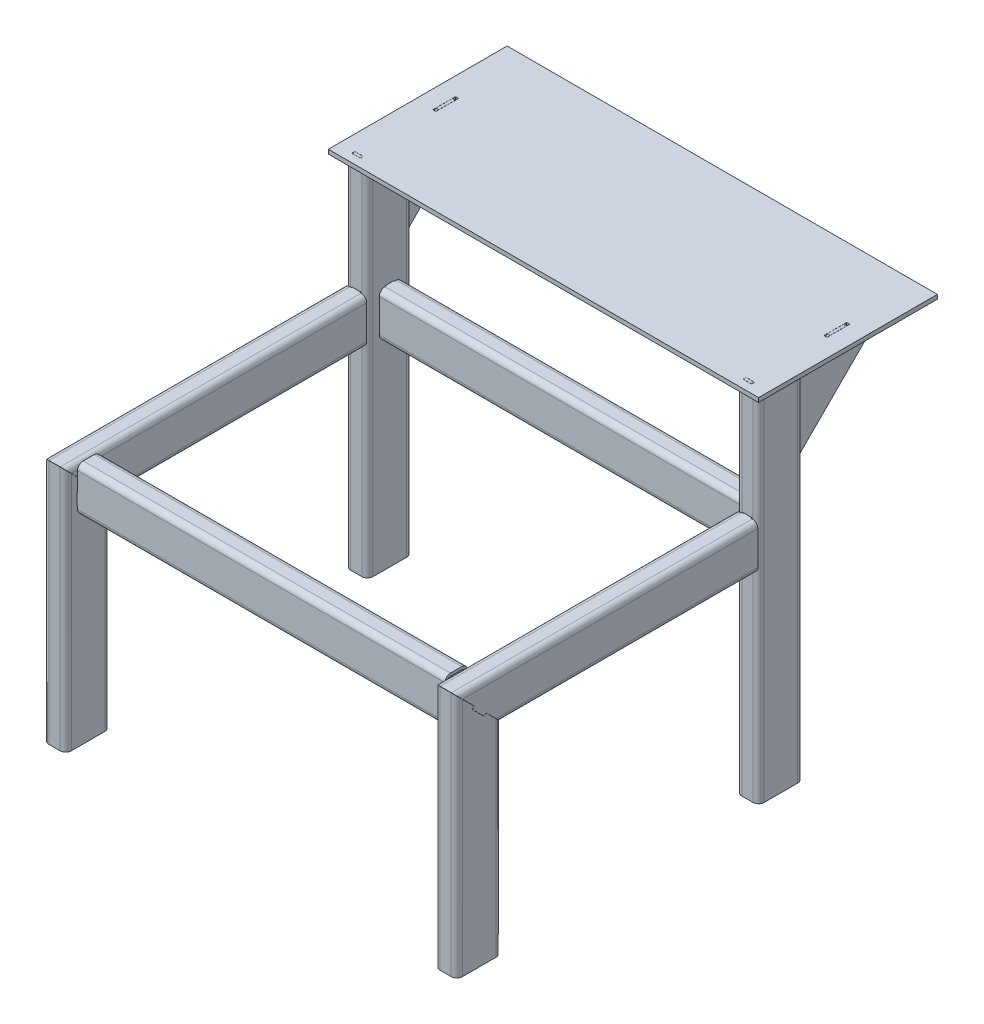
SolidWorks part; units mm, degrees
other "ExplView1" [suppressed]
other "Explode Step1" [suppressed]
other "Explode Line1"
other "Explode Line2"
other "Explode Line3"
other "Explode Line4"
other "Explode Line5"
other "Explode Line6"
other "Explode Step2" [suppressed]
other "Explode Line1"
other "Explode Line2"
other "Explode Line3"
other "Explode Line4"
other "Explode Line5"
other "Explode Line6"
other "Explode Line7"
other "Explode Line8"
other "Explode Step3" [suppressed]
other "Explode Line1"
other "Explode Line2"
other "Explode Line3"
other "Explode Line4"
other "Explode Line5"
other "Explode Line6"
other "Explode Step4" [suppressed]
other "Explode Line1"
other "Explode Line2"
other "Explode Line3"
other "Explode Line4"
other "Explode Step5" [suppressed]
other "Explode Line1"
other "Explode Step6" [suppressed]
other "Explode Line1"
other "Explode Line2"
ref_plane "Front Plane" through (0, 0, 0) normal (0, 0, 1) x (1, 0, 0)
ref_plane "Top Plane" through (0, 0, 0) normal (0, 1, 0) x (1, 0, 0)
ref_plane "Right Plane" through (0, 0, 0) normal (1, 0, 0) x (0, 0, -1)
sketch3d "3DSketch1"
  line L0 (0, 0, 0) -> (0, 558.8, 0)
  line L1 (0, 558.8, 0) -> (889, 558.8, 0)
  line L2 (889, 558.8, 0) -> (889, 0, 0)
  line L3 (889, 0, 0) -> (0, 0, 0) construction
  line L4 (0, 0, 0) -> (0, 0, -685.8) construction
  line L5 (0, 0, -685.8) -> (889, 0, -685.8) construction
  line L6 (889, 0, -685.8) -> (889, 0, 0) construction
  line L7 (0, 0, -685.8) -> (0, 812.8, -685.8)
  line L8 (889, 0, -685.8) -> (889, 812.8, -685.8)
  line L9 (889, 812.8, -685.8) -> (0, 812.8, -685.8) construction
  line L10 (0, 558.8, 0) -> (0, 558.8, -685.8)
  line L11 (0, 558.8, -685.8) -> (889, 558.8, -685.8)
  line L12 (889, 558.8, -685.8) -> (889, 558.8, 0)
  dimension "D2" = 685.8
  dimension "D1" = 558.8
  dimension "D3" = 889
  dimension "D4" = 812.8
other "Rectangular tube 4 X 2 X 0.25(2)"
ref_plane "Plane1" through (0, 0, 0) normal (0, 1, 0) x (1, 0, 0)
sketch "Sketch1" plane through (0, 0, 0) normal (0, 1, 0) x (1, 0, 0)
  line L0 (-12.7, -44.45) -> (12.7, -44.45)
  line L1 (-19.05, -38.1) -> (-19.05, 38.1)
  line L2 (12.7, 44.45) -> (-12.7, 44.45)
  line L3 (19.05, 38.1) -> (19.05, -38.1)
  line L4 (-12.7, -50.8) -> (12.7, -50.8)
  line L5 (-25.4, -38.1) -> (-25.4, 38.1)
  line L6 (12.7, 50.8) -> (-12.7, 50.8)
  line L7 (25.4, 38.1) -> (25.4, -38.1)
  line L8 (0, 0) -> (25.4, 0) construction
  line L9 (0, 0) -> (0, 50.8) construction
  arc A0 (25.4, 38.1) -> (12.7, 50.8) centre (12.7, 38.1) ccw
  arc A1 (12.7, -50.8) -> (25.4, -38.1) centre (12.7, -38.1) ccw
  arc A2 (-25.4, -38.1) -> (-12.7, -50.8) centre (-12.7, -38.1) ccw
  arc A3 (-12.7, 50.8) -> (-25.4, 38.1) centre (-12.7, 38.1) ccw
  arc A4 (-12.7, 44.45) -> (-19.05, 38.1) centre (-12.7, 38.1) ccw
  arc A5 (19.05, 38.1) -> (12.7, 44.45) centre (12.7, 38.1) ccw
  arc A6 (12.7, -44.45) -> (19.05, -38.1) centre (12.7, -38.1) ccw
  arc A7 (-19.05, -38.1) -> (-12.7, -44.45) centre (-12.7, -38.1) ccw
  point P3 (0, -50.8)
  point P4 (-25.4, 0)
  point P5 (0, 0)
  point P6 (25.4, -50.8)
  point P7 (-25.4, -50.8)
  point P8 (-25.4, 50.8)
  point P33 (0, 0)
  point P35 (25.4, 50.8)
  point P36 (25.4, 0)
  point P37 (0, 50.8)
  dimension "D1" = 12.7
  dimension "Thickness" = 6.35
  dimension "V_leg" = 101.6
  dimension "H_leg" = 50.8
sketch "Sketch2" plane through (0, 812.8, 0) normal (0, 1, 0) x (1, 0, 0)
  line L0 (-12.7, 635) -> (12.7, 635) construction
  line L1 (-44.45, 615.95) -> (933.45, 615.95)
  line L2 (-44.45, 615.95) -> (-44.45, 1022.35)
  line L3 (-44.45, 1022.35) -> (933.45, 1022.35)
  line L4 (933.45, 615.95) -> (933.45, 1022.35)
  line L5 (-25.4, 723.9) -> (-25.4, 647.7) construction
  line L6 (914.4, 647.7) -> (914.4, 723.9) construction
  dimension "D1" = 19.05
  dimension "D2" = 19.05
  dimension "D3" = 19.05
  dimension "D4" = 406.4
extrude "Boss-Extrude1" add sketch "Sketch2" along normal blind 9.525 separate body
other "Trim/Extend1"
other "Trim/Extend2"
other "Gusset1" parameters "D1"=6.35, "D2"=6.35, "D3"=0, "D4"=0, "D10"=6.35, "D11"=203.2, "D12"=203.2, "D13"=12.7, "D14"=45, "D15"=12.7
sketch "Sketch14" plane through (0, 812.8, -736.6) normal (1, 0, 0) x (0, 0, -1)
  line L0 (0, 0) -> (203.2, 0)
  line L1 (0, 0) -> (0, -203.2)
  line L2 (203.2, 0) -> (0, -203.2)
other "Gusset2" parameters "D1"=6.35, "D2"=6.35, "D3"=0, "D4"=0, "D10"=6.35, "D11"=203.2, "D12"=203.2, "D13"=12.7, "D14"=45, "D15"=12.7
sketch "Sketch15" plane through (889, 812.8, -736.6) normal (1, 0, 0) x (0, 0, -1)
  line L0 (0, 0) -> (203.2, 0)
  line L1 (0, 0) -> (0, -203.2)
  line L2 (203.2, 0) -> (0, -203.2)
tab and slot "Tab and Slot-Tab1" parameters "D110"=6.35, "D18"=44.45, "D19"=0, "D10"=25.4, "D11"=1, "D17"=0.254
tab and slot "Tab and Slot-Slot1"
tab and slot "Tab and Slot-Tab2" parameters "D410"=6.35, "D48"=38.1, "D49"=0, "D40"=38.1, "D41"=1, "D43"=3.81, "D47"=0.254, "D510"=6.35, "D58"=38.1, "D59"=0, "D50"=38.1, "D51"=1, "D53"=6.35, "D57"=0.254
tab and slot "Tab and Slot-Slot2"
tab and slot "Tab and Slot-Tab3" parameters "D110"=6.35, "D18"=3.175, "D19"=0, "D10"=19.05, "D11"=1, "D17"=0.254, "D210"=6.35, "D28"=3.175, "D29"=0, "D20"=19.05, "D21"=1, "D27"=0.254
tab and slot "Tab and Slot-Slot3"
tab and slot "Tab and Slot-Tab4" parameters "D110"=6.35, "D18"=3.175, "D19"=0, "D10"=19.05, "D11"=1, "D13"=0, "D17"=0.254, "D210"=6.35, "D28"=3.175, "D29"=0, "D20"=19.05, "D21"=1, "D27"=0.254
tab and slot "Tab and Slot-Slot4"
tab and slot "Tab and Slot-Tab5" parameters "D110"=6.35, "D18"=3.175, "D19"=0, "D10"=11.43, "D11"=1, "D17"=0.254, "D210"=6.35, "D28"=3.175, "D29"=0, "D20"=19.05, "D21"=1, "D27"=0.254
tab and slot "Tab and Slot-Slot5"
tab and slot "Tab and Slot-Tab6" parameters "D110"=6.35, "D18"=3.175, "D19"=0, "D10"=19.05, "D11"=1, "D13"=0, "D17"=0.762, "D210"=6.35, "D28"=3.175, "D29"=0, "D20"=19.05, "D21"=1, "D27"=0.2
tab and slot "Tab and Slot-Slot6"
tab and slot "Tab and Slot-Tab7" parameters "D710"=6.35, "D78"=38.1, "D79"=0, "D70"=38.1, "D71"=1, "D73"=6.35, "D77"=0.254, "D910"=6.35, "D98"=38.1, "D99"=0, "D90"=38.1, "D91"=1, "D93"=6.35, "D97"=0.254
tab and slot "Tab and Slot-Slot7"
tab and slot "Tab and Slot-Tab8" parameters "D110"=6.35, "D18"=44.45, "D19"=0, "D10"=25.4, "D11"=1, "D17"=0.254
tab and slot "Tab and Slot-Slot8"
tab and slot "Tab and Slot-Tab9" parameters "D110"=6.35, "D18"=3.175, "D19"=0, "D10"=19.05, "D11"=1, "D17"=0.254
tab and slot "Tab and Slot-Slot9"
tab and slot "Tab and Slot-Tab10" parameters "D110"=6.35, "D18"=3.175, "D19"=0, "D10"=19.05, "D11"=1, "D17"=0.254
tab and slot "Tab and Slot-Slot10"
tab and slot "Tab and Slot-Tab11" parameters "D110"=6.35, "D18"=76.2, "D19"=0, "D10"=50.8, "D11"=1, "D16"=6.35, "D17"=0.254
tab and slot "Tab and Slot-Slot11"
tab and slot "Tab and Slot-Tab12" parameters "D110"=6.35, "D18"=76.2, "D19"=0, "D10"=50.8, "D11"=1, "D16"=3.175, "D17"=0.254
tab and slot "Tab and Slot-Slot12"
tab and slot "Tab and Slot-Tab13" parameters "D110"=6.35, "D18"=76.2, "D19"=0, "D10"=50.8, "D11"=1, "D16"=6.35, "D17"=0.254
tab and slot "Tab and Slot-Slot13"
tab and slot "Tab and Slot-Tab14" parameters "D110"=6.35, "D18"=76.2, "D19"=0, "D10"=50.8, "D11"=1, "D16"=3.175, "D17"=0.254
tab and slot "Tab and Slot-Slot14"
tab and slot "Tab and Slot-Tab16" parameters "D110"=6.35, "D18"=6.35, "D19"=0, "D10"=25.4, "D11"=1, "D17"=0.254
tab and slot "Tab and Slot-Slot15"
tab and slot "Tab and Slot-Tab17" parameters "D110"=6.35, "D18"=6.35, "D19"=0, "D10"=25.4, "D11"=1, "D17"=0.254
tab and slot "Tab and Slot-Slot16"
move or copy body "Body-Move/Copy1" [suppressed] bodies to move or copy 173 copy no translate (100.857, 0, 0)
move or copy body "Body-Move/Copy2" [suppressed] bodies to move or copy 153 copy no translate (100.857, 0, 0)
move or copy body "Body-Move/Copy3" [suppressed] bodies to move or copy 172 copy no translate (100.857, 0, 0)
move or copy body "Body-Move/Copy4" [suppressed] bodies to move or copy 166 copy no translate (100.857, 0, 0)
move or copy body "Body-Move/Copy5" [suppressed] bodies to move or copy 165 copy no translate (100.857, 0, 0)
move or copy body "Body-Move/Copy6" [suppressed] bodies to move or copy 146 copy no translate (100.857, 0, 0)
move or copy body "Body-Move/Copy7" [suppressed] bodies to move or copy 174 copy no translate (0, 0, -70.0709)
move or copy body "Body-Move/Copy8" [suppressed] bodies to move or copy 162 copy no translate (0, 0, -70.0709)
move or copy body "Body-Move/Copy9" [suppressed] bodies to move or copy 125 copy no translate (0, 0, -70.0709)
move or copy body "Body-Move/Copy10" [suppressed] bodies to move or copy 122 copy no translate (0, 0, -70.0709)
move or copy body "Body-Move/Copy11" [suppressed] bodies to move or copy 123 copy no translate (0, 0, -70.0709)
move or copy body "Body-Move/Copy12" [suppressed] bodies to move or copy 124 copy no translate (0, 0, -70.0709)
move or copy body "Body-Move/Copy13" [suppressed] bodies to move or copy 164 copy no translate (0, 0, -70.0709)
move or copy body "Body-Move/Copy14" [suppressed] bodies to move or copy 127 copy no translate (0, 0, -64.4601)
move or copy body "Body-Move/Copy15" [suppressed] bodies to move or copy 128 copy no translate (0, 0, -64.4601)
move or copy body "Body-Move/Copy16" [suppressed] bodies to move or copy 130 copy no translate (0, 0, -64.4601)
move or copy body "Body-Move/Copy17" [suppressed] bodies to move or copy 131 copy no translate (0, 0, -64.4601)
move or copy body "Body-Move/Copy18" [suppressed] bodies to move or copy 132 copy no translate (0, 0, -64.4601)
move or copy body "Body-Move/Copy19" [suppressed] bodies to move or copy 161 copy no translate (0, 0, -64.4601)
move or copy body "Body-Move/Copy20" [suppressed] bodies to move or copy 138 copy no translate (0, 0, -70.0709)
move or copy body "Body-Move/Copy21" [suppressed] bodies to move or copy 121 copy no translate (146.6491, 0, 0)
move or copy body "Body-Move/Copy22" [suppressed] bodies to move or copy 129 copy no translate (146.6491, 0, 0)
move or copy body "Body-Move/Copy23" [suppressed] bodies to move or copy 135 copy no translate (146.6491, 0, 0)
move or copy body "Body-Move/Copy24" [suppressed] bodies to move or copy 136 copy no translate (146.6491, 0, 0)
move or copy body "Body-Move/Copy25" [suppressed] bodies to move or copy 137 copy no translate (0, 189.309, 0)
move or copy body "Body-Move/Copy26" [suppressed] bodies to move or copy 139 copy no translate (0, 0, -105.3822)
move or copy body "Body-Move/Copy27" [suppressed] bodies to move or copy 143 copy no translate (0, 0, -105.3822)
